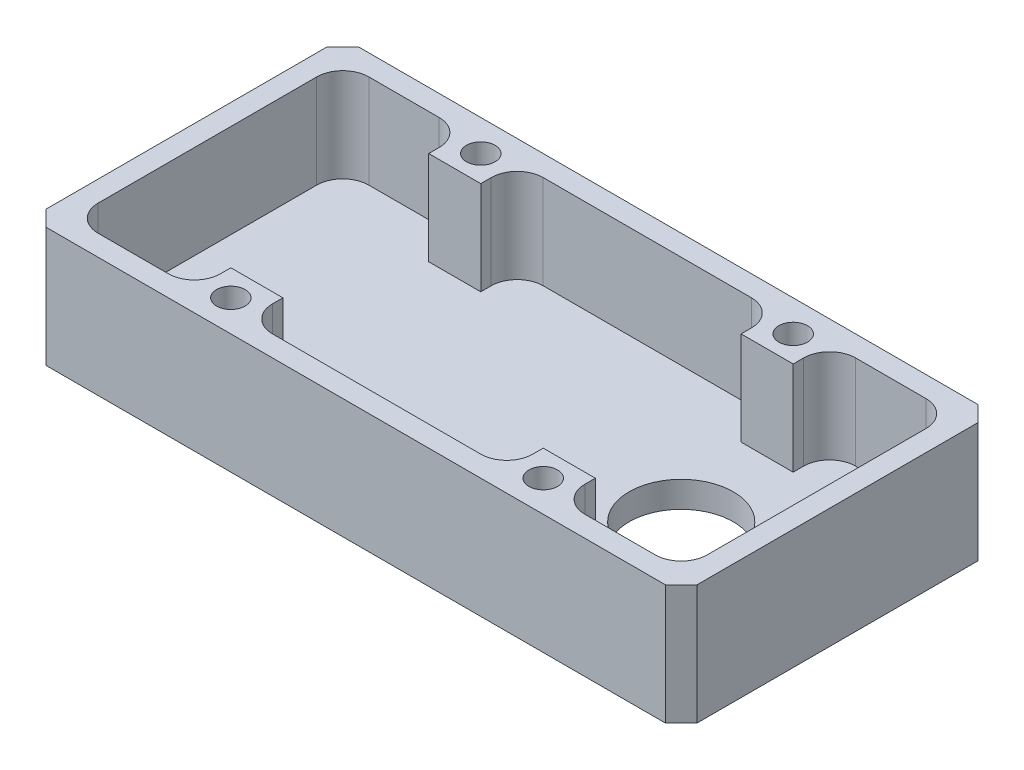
SolidWorks part; units mm, degrees
ref_plane "Спереди" through (0, 0, 0) normal (0, 0, 1) x (1, 0, 0)
ref_plane "Сверху" through (0, 0, 0) normal (0, 1, 0) x (1, 0, 0)
ref_plane "Справа" through (0, 0, 0) normal (1, 0, 0) x (0, 0, -1)
sketch "Эскиз1" plane through (0, 0, 0) normal (0, 1, 0) x (1, 0, 0)
  line L1 (62.5, -30) -> (-62.5, -30)
  line L2 (62.5, -30) -> (62.5, 30)
  line L3 (62.5, 30) -> (-62.5, 30)
  line L4 (-62.5, -30) -> (-62.5, 30)
  line L5 (0, 30) -> (0, -30) construction
  line L6 (62.5, 0) -> (-62.5, 0) construction
  point P0 (0, 0)
  dimension "D1" = 60
  dimension "D2" = 125
extrude "Бобышка-Вытянуть1" add sketch "Эскиз1" along normal blind 23
sketch "Эскиз2" plane through (0, 23, 0) normal (0, 1, 0) x (1, 0, 0)
  line L0 (0, 33.2872) -> (0, -34.7147) construction
  line L1 (-72.4143, 0) -> (68.9104, 0) construction
  line L2 (-58.5, -21) -> (-58.5, 21)
  line L3 (-53.5, 26) -> (-40, 26)
  line L4 (-35, 21) -> (-35, 19)
  line L5 (-35, 19) -> (-25, 19)
  line L6 (-25, 19) -> (-25, 21)
  line L7 (-20, 26) -> (20, 26)
  line L8 (25, 19) -> (25, 21)
  line L9 (35, 19) -> (25, 19)
  line L10 (35, 21) -> (35, 19)
  line L11 (53.5, 26) -> (40, 26)
  line L12 (58.5, -21) -> (58.5, 21)
  line L13 (53.5, -26) -> (40, -26)
  line L14 (35, -21) -> (35, -19)
  line L15 (35, -19) -> (25, -19)
  line L16 (25, -19) -> (25, -21)
  line L17 (-20, -26) -> (20, -26)
  line L18 (-25, -19) -> (-25, -21)
  line L19 (-35, -19) -> (-25, -19)
  line L20 (-35, -21) -> (-35, -19)
  line L21 (-53.5, -26) -> (-40, -26)
  line L22 (-62.5, -30) -> (62.5, -30) construction
  line L23 (-62.5, 30) -> (-62.5, -30) construction
  line L24 (62.5, 30) -> (-62.5, 30) construction
  arc A0 (-53.5, -26) -> (-58.5, -21) centre (-53.5, -21) cw
  arc A1 (-35, -21) -> (-40, -26) centre (-40, -21) cw
  arc A2 (-20, -26) -> (-25, -21) centre (-20, -21) cw
  arc A3 (25, -21) -> (20, -26) centre (20, -21) cw
  arc A4 (40, -26) -> (35, -21) centre (40, -21) cw
  arc A5 (53.5, -26) -> (58.5, -21) centre (53.5, -21) ccw
  arc A6 (53.5, 26) -> (58.5, 21) centre (53.5, 21) cw
  arc A7 (35, 21) -> (40, 26) centre (40, 21) cw
  arc A8 (25, 21) -> (20, 26) centre (20, 21) ccw
  arc A9 (-25, 21) -> (-20, 26) centre (-20, 21) cw
  arc A10 (-40, 26) -> (-35, 21) centre (-40, 21) cw
  arc A11 (-58.5, 21) -> (-53.5, 26) centre (-53.5, 21) cw
  point P13 (0, 26)
  point P19 (58.5, 0)
  point P28 (-58.5, 0)
  point P36 (-58.5, -26)
  point P39 (-35, -26)
  point P42 (-25, -26)
  point P45 (25, -26)
  point P48 (35, -26)
  point P51 (58.5, -26)
  point P54 (58.5, 26)
  point P57 (35, 26)
  point P60 (25, 26)
  point P63 (-25, 26)
  point P66 (-35, 26)
  point P69 (-58.5, 26)
  dimension "D6" = 5
  dimension "D1" = 11
  dimension "D2" = 4
  dimension "D3" = 23.5
  dimension "D4" = 10
  dimension "D5" = 4
extrude "Вырез-Вытянуть1" cut sketch "Эскиз2" against normal blind 18
sketch "Эскиз3" plane through (0, 23, 0) normal (0, 1, 0) x (1, 0, 0)
  line L0 (0, 35.1041) -> (0, -38.608) construction
  line L1 (-73.712, 0) -> (67.4829, 0) construction
  line L2 (-62.5, 30) -> (-62.5, -30) construction
  circle A0 centre (-30, -24) radius 2.75
  circle A1 centre (-30, 24) radius 2.75
  circle A2 centre (30, -24) radius 2.75
  circle A3 centre (30, 24) radius 2.75
  dimension "D1" = 5.5
  dimension "D2" = 48
  dimension "D3" = 32.5
extrude "Вырез-Вытянуть2" cut sketch "Эскиз3" against normal through all
sketch "Эскиз4" plane through (0, 5, 0) normal (0, 1, 0) x (1, 0, 0)
  line L0 (62.5, -30) -> (62.5, 30) construction
  circle A0 centre (32.5, 0) radius 10
  dimension "D1" = 20
  dimension "D2" = 30
extrude "Вырез-Вытянуть3" cut sketch "Эскиз4" against normal through all
chamfer "Фаска1" distance 3 angle 45 4 edges at (-62.5, 11.5, -30) (62.5, 11.5, -30) (62.5, 11.5, 30) (-62.5, 11.5, 30)
